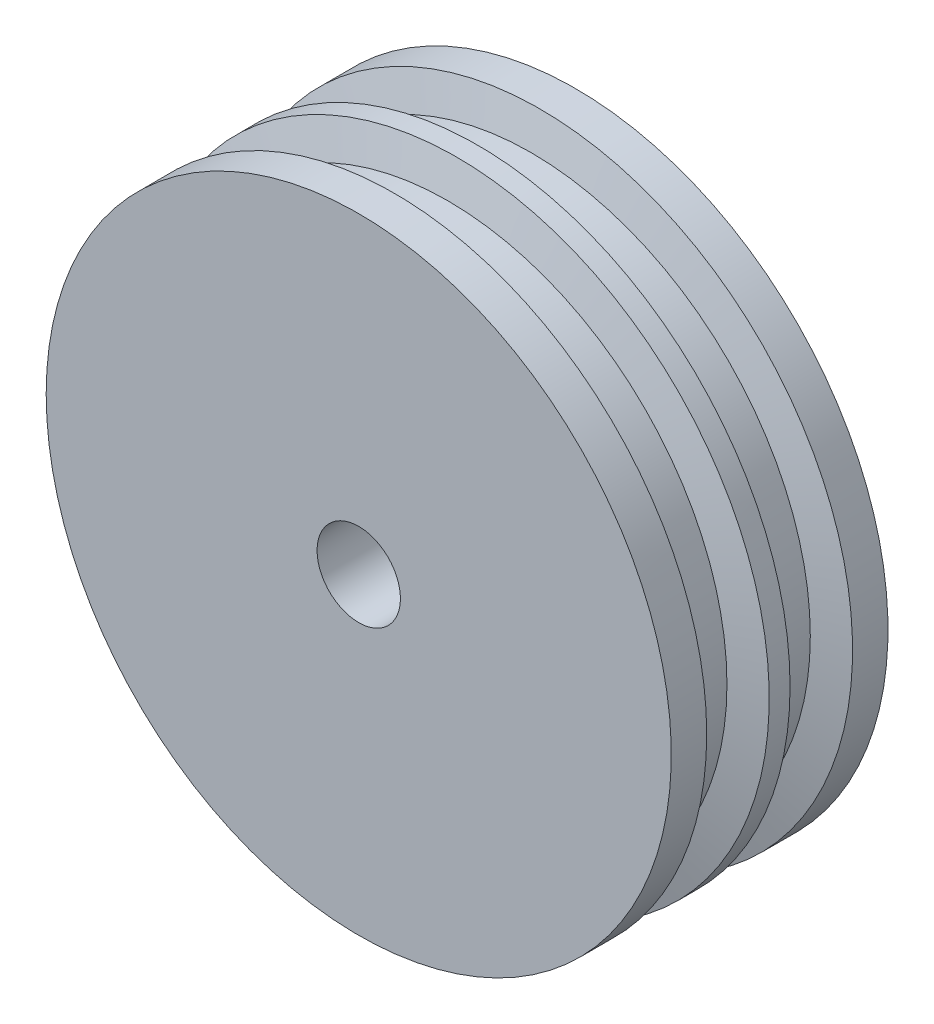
SolidWorks part; units mm, degrees
ref_plane "Vorne" through (0, 0, 0) normal (0, 0, 1) x (1, 0, 0)
ref_plane "Oben" through (0, 0, 0) normal (0, 1, 0) x (1, 0, 0)
ref_plane "Rechts" through (0, 0, 0) normal (1, 0, 0) x (0, 0, -1)
sketch "Skizze1" plane through (0, 0, 0) normal (0, 0, 1) x (1, 0, 0)
  circle A0 centre (0, 0) radius 75
  circle A1 centre (0, 0) radius 10
  dimension "D1" = 150
  dimension "D2" = 20
extrude "Linear austragen1" add sketch "Skizze1" along normal mid plane 52
sketch "Skizze2" plane through (0, 0, 0) normal (1, 0, 0) x (0, 0, -1)
  line L0 (-17.5, 75) -> (-2.5, 75)
  line L1 (-2.5, 75) -> (-4.6436, 67)
  line L2 (-4.6436, 67) -> (-15.3564, 67)
  line L3 (-15.3564, 67) -> (-17.5, 75)
  line L4 (-10, 67) -> (-10, 75) construction
  line L5 (26, 75) -> (-26, 75) construction
  line L6 (0, 0) -> (0, 29.6408) construction
  line L7 (0, 0) -> (23.4083, 0) construction
  dimension "D1" = 15
  dimension "D2" = 30
  dimension "D3" = 8
  dimension "D4" = 10
revolve "Schnitt-Rotation1" cut sketch "Skizze2" angle 360 about L7
pattern_linear "Lineares Muster1" count 2 spacing 20 along (0, 0, -1) of "Schnitt-Rotation1"
equation "\"D1@Lineares Muster1\" = int(\"Scheibenbreite\" / 20)"
equation "\"D4@Skizze2\" = ( \"D1@Lineares Muster1\" *10) - 10"
